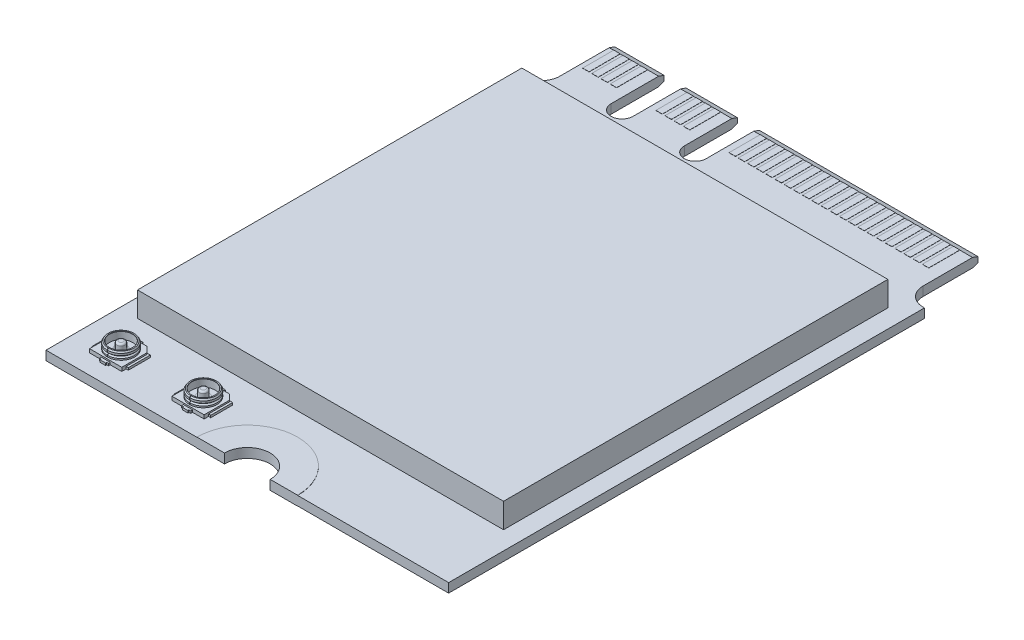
SolidWorks part; units mm, degrees
other "<CONMHF4-SMD-G-T4>-<Boss-Extrude2[1]>"
other "<CONMHF4-SMD-G-T4>-<Cut-Extrude5>"
other "<CONMHF4-SMD-G-T4>-<Boss-Extrude2[3]>"
other "<CONMHF4-SMD-G-T4>-<Boss-Extrude2[2]>"
other "<CONMHF4-SMD-G-T4>-<Chamfer2>"
other "<CONMHF4-SMD-G-T4>-<Boss-Extrude3>"
other "<CONMHF4-SMD-G-T4>-<Fillet3>"
other "<CONMHF4-SMD-G-T4>-<Boss-Extrude2[1]>"
other "<CONMHF4-SMD-G-T4>-<Cut-Extrude5>"
other "<CONMHF4-SMD-G-T4>-<Boss-Extrude2[3]>"
other "<CONMHF4-SMD-G-T4>-<Boss-Extrude2[2]>"
other "<CONMHF4-SMD-G-T4>-<Chamfer2>"
other "<CONMHF4-SMD-G-T4>-<Boss-Extrude3>"
other "<CONMHF4-SMD-G-T4>-<Fillet3>"
ref_plane "Front" through (0, 0, 0) normal (0, 0, 1) x (1, 0, 0)
ref_plane "Top" through (0, 0, 0) normal (0, 1, 0) x (1, 0, 0)
ref_plane "Right" through (0, 0, 0) normal (1, 0, 0) x (0, 0, -1)
sketch "Sketch1" plane through (0, 0, 0) normal (0, 1, 0) x (1, 0, 0)
  line L0 (0, 0) -> (0, 10) construction
  line L1 (1.25, -20) -> (11, -20)
  line L3 (-11, 6) -> (-11, -20)
  line L4 (-11, -20) -> (-1.25, -20)
  line L5 (11, 6) -> (11, -20)
  line L6 (-11, 6) -> (-10.925, 6)
  line L7 (-9.925, 10) -> (-9.925, 7)
  line L8 (9.925, 10) -> (9.925, 7)
  line L9 (10.925, 6) -> (11, 6)
  line L10 (-6.025, 7.1) -> (-6.025, 10)
  line L11 (-2.025, 10) -> (9.925, 10)
  line L12 (-7.225, 7.1) -> (-7.225, 10)
  line L13 (-9.925, 10) -> (-7.225, 10)
  line L15 (0, 10) -> (0, -20) construction
  line L16 (-3.225, 10) -> (-6.025, 10)
  line L18 (0, -50) -> (0, 50) construction
  line L19 (-50, 0) -> (50, 0) construction
  line L20 (-3.225, 10) -> (-3.225, 7.1)
  line L21 (-2.025, 10) -> (-2.025, 7.1)
  arc A0 (1.25, -20) -> (-1.25, -20) centre (0, -20) ccw
  arc A1 (9.925, 7) -> (10.925, 6) centre (10.925, 7) ccw
  arc A2 (-9.925, 7) -> (-10.925, 6) centre (-10.925, 7) cw
  arc A3 (-7.225, 7.1) -> (-6.025, 7.1) centre (-6.625, 7.1) ccw
  arc A5 (-2.025, 7.1) -> (-3.225, 7.1) centre (-2.625, 7.1) cw
  point P3 (-11, 40)
  point P6 (11, 40)
  point P18 (9.925, 6)
  point P42 (9.925, 8.5)
  dimension "D5" = 1.25
  dimension "D2" = 1
  dimension "D12" = 3
  dimension "D1" = 11
  dimension "D3" = 30
  dimension "D4" = 22
  dimension "D6" = 6.625
  dimension "D7" = 2.9
  dimension "D9" = 1.2
  dimension "D10" = 10
  dimension "D11" = 19.85
  dimension "D13" = 2.625
extrude "Boss-Extrude1" add sketch "Sketch1" against normal blind 0.5
sketch "Sketch5" plane through (9.925, 0, 0) normal (1, 0, 0) x (0, 0, -1)
  line L0 (10, 0) -> (9.7, 0)
  line L1 (7, 0) -> (10, 0) construction
  line L2 (10, 0) -> (10, -0.1092)
  line L3 (10, -0.1092) -> (9.7, 0)
  line L4 (10, -0.25) -> (9.7, -0.25) construction
  line L5 (10, -0.5) -> (10, 0) construction
  line L6 (10, -0.3908) -> (9.7, -0.5)
  line L7 (10, -0.5) -> (10, -0.3908)
  line L8 (10, -0.5) -> (9.7, -0.5)
  dimension "D1" = 20
  dimension "D2" = 0.2816
extrude "Cut-Extrude2" cut sketch "Sketch5" against normal through all
sketch "Sketch7" plane through (0, 0, 0) normal (0, 1, 0) x (1, 0, 0)
  line L1 (-10, 5) -> (10, 5)
  line L2 (-10, 5) -> (-10, -16)
  line L3 (-10, -16) -> (10, -16)
  line L4 (10, 5) -> (10, -16)
  line L6 (-11, -20) -> (-1.25, -20) construction
  line L7 (0, 5) -> (0, -16) construction
  line L8 (0, -50) -> (0, 50) construction
  dimension "D1" = 21
  dimension "D2" = 20
  dimension "D3" = 4
extrude "Boss-Extrude3" add sketch "Sketch7" along normal blind 1.35
sketch "Sketch12" plane through (0, -0.5, 0) normal (0, -1, 0) x (1, 0, 0)
  line L0 (-2.75, 20) -> (-1.25, 20)
  line L1 (1.25, 20) -> (2.75, 20)
  arc A1 (-1.25, 20) -> (1.25, 20) centre (0, 20) ccw construction
  arc A4 (-1.25, 20) -> (1.25, 20) centre (0, 20) ccw
  arc A5 (-2.75, 20) -> (2.75, 20) centre (0, 20) ccw
  dimension "D2" = 5.5
extrude "Boss-Extrude6" add sketch "Sketch12" along normal blind 0.01
ref_plane "Plane2" through (0, -0.25, 0) normal (0, 1, 0) x (1, 0, 0)
sketch "Sketch15" plane through (0, 0, 0) normal (0, 1, 0) x (1, 0, 0)
  line L2 (-2.75, -20) -> (-1.25, -20)
  line L3 (1.25, -20) -> (2.75, -20)
  arc A0 (1.25, -20) -> (-1.25, -20) centre (0, -20) ccw construction
  arc A1 (1.25, -20) -> (-1.25, -20) centre (0, -20) ccw
  arc A2 (2.75, -20) -> (-2.75, -20) centre (0, -20) ccw construction
  arc A3 (2.75, -20) -> (-2.75, -20) centre (0, -20) ccw
extrude "Boss-Extrude9" add sketch "Sketch15" along normal blind 0.01
sketch "Sketch18" plane through (0, -0.5, 0) normal (0, -1, 0) x (1, 0, 0)
  line L3 (-9.425, -7.5) -> (-9.075, -7.5)
  line L4 (-8.925, -7.5) -> (-8.575, -7.5)
  line L5 (-8.925, -7.5) -> (-8.925, -9.7)
  line L6 (-9.925, -9.7) -> (-7.225, -9.7) construction
  line L7 (-9.425, -7.5) -> (-9.425, -9.7)
  line L8 (-9.075, -7.5) -> (-9.075, -9.7)
  line L9 (-9.075, -9.7) -> (-9.425, -9.7)
  line L10 (-8.575, -7.5) -> (-8.575, -9.7)
  line L11 (-8.575, -9.7) -> (-8.925, -9.7)
  line L12 (-8.425, -7.5) -> (-8.075, -7.5)
  line L13 (-8.425, -7.5) -> (-8.425, -9.7)
  line L14 (-8.075, -7.5) -> (-8.075, -9.7)
  line L15 (-8.075, -9.7) -> (-8.425, -9.7)
  line L16 (-7.925, -7.5) -> (-7.575, -7.5)
  line L17 (-7.925, -7.5) -> (-7.925, -9.7)
  line L18 (-7.575, -7.5) -> (-7.575, -9.7)
  line L19 (-7.575, -9.7) -> (-7.925, -9.7)
  line L24 (-9.925, -10) -> (-7.225, -10) construction
  line L25 (-7.075, -9.7) -> (-7.425, -9.7)
  line L26 (-7.425, -7.5) -> (-7.425, -9.7)
  line L27 (-7.425, -7.5) -> (-7.075, -7.5)
  line L28 (-7.075, -7.5) -> (-7.075, -9.7)
  point P5 (-7.75, -9.7)
  point P24 (-8.25, -9.7)
  dimension "D1" = 0.35
  dimension "D3" = 0.5
  dimension "D2" = 1.125
  dimension "D4" = 5
  dimension "D5" = 2.5
extrude "Boss-Extrude12" add sketch "Sketch18" along normal blind 0.01
sketch "Sketch19" plane through (0, -0.5, 0) normal (0, -1, 0) x (1, 0, 0)
  line L2 (-7.575, -9.7) -> (-7.575, -7.5) construction
  line L3 (8.575, -7.5) -> (8.925, -7.5)
  line L4 (8.575, -9.7) -> (8.925, -9.7)
  line L5 (8.075, -7.5) -> (8.425, -7.5)
  line L6 (8.575, -7.5) -> (8.575, -9.7)
  line L7 (8.925, -7.5) -> (8.925, -9.7)
  line L8 (8.075, -9.7) -> (8.425, -9.7)
  line L9 (8.075, -7.5) -> (8.075, -9.7)
  line L10 (8.425, -7.5) -> (8.425, -9.7)
  line L11 (7.575, -7.5) -> (7.925, -7.5)
  line L12 (7.575, -9.7) -> (7.925, -9.7)
  line L13 (7.575, -7.5) -> (7.575, -9.7)
  line L14 (7.925, -7.5) -> (7.925, -9.7)
  line L15 (7.075, -7.5) -> (7.425, -7.5)
  line L16 (7.075, -9.7) -> (7.425, -9.7)
  line L17 (7.075, -7.5) -> (7.075, -9.7)
  line L18 (7.425, -7.5) -> (7.425, -9.7)
  line L19 (6.575, -7.5) -> (6.925, -7.5)
  line L20 (6.575, -9.7) -> (6.925, -9.7)
  line L21 (6.575, -7.5) -> (6.575, -9.7)
  line L22 (6.925, -7.5) -> (6.925, -9.7)
  line L23 (6.075, -7.5) -> (6.425, -7.5)
  line L24 (6.075, -9.7) -> (6.425, -9.7)
  line L25 (6.075, -7.5) -> (6.075, -9.7)
  line L26 (6.425, -7.5) -> (6.425, -9.7)
  line L27 (5.575, -7.5) -> (5.925, -7.5)
  line L28 (5.575, -9.7) -> (5.925, -9.7)
  line L29 (5.575, -7.5) -> (5.575, -9.7)
  line L30 (5.925, -7.5) -> (5.925, -9.7)
  line L31 (5.075, -7.5) -> (5.425, -7.5)
  line L32 (5.075, -9.7) -> (5.425, -9.7)
  line L33 (5.075, -7.5) -> (5.075, -9.7)
  line L34 (5.425, -7.5) -> (5.425, -9.7)
  line L35 (4.575, -7.5) -> (4.925, -7.5)
  line L36 (4.575, -9.7) -> (4.925, -9.7)
  line L37 (4.575, -7.5) -> (4.575, -9.7)
  line L38 (4.925, -7.5) -> (4.925, -9.7)
  line L39 (4.075, -7.5) -> (4.425, -7.5)
  line L40 (4.075, -9.7) -> (4.425, -9.7)
  line L41 (4.075, -7.5) -> (4.075, -9.7)
  line L42 (4.425, -7.5) -> (4.425, -9.7)
  line L43 (3.575, -7.5) -> (3.925, -7.5)
  line L44 (3.575, -9.7) -> (3.925, -9.7)
  line L45 (3.575, -7.5) -> (3.575, -9.7)
  line L46 (3.925, -7.5) -> (3.925, -9.7)
  line L47 (3.075, -7.5) -> (3.425, -7.5)
  line L48 (3.075, -9.7) -> (3.425, -9.7)
  line L49 (3.075, -7.5) -> (3.075, -9.7)
  line L50 (3.425, -7.5) -> (3.425, -9.7)
  line L51 (2.575, -7.5) -> (2.925, -7.5)
  line L52 (2.575, -9.7) -> (2.925, -9.7)
  line L53 (2.575, -7.5) -> (2.575, -9.7)
  line L54 (2.925, -7.5) -> (2.925, -9.7)
  line L55 (2.075, -7.5) -> (2.425, -7.5)
  line L56 (2.075, -9.7) -> (2.425, -9.7)
  line L57 (2.075, -7.5) -> (2.075, -9.7)
  line L58 (2.425, -7.5) -> (2.425, -9.7)
  line L59 (1.575, -7.5) -> (1.925, -7.5)
  line L60 (1.575, -9.7) -> (1.925, -9.7)
  line L61 (1.575, -7.5) -> (1.575, -9.7)
  line L62 (1.925, -7.5) -> (1.925, -9.7)
  line L63 (1.075, -7.5) -> (1.425, -7.5)
  line L64 (1.075, -9.7) -> (1.425, -9.7)
  line L65 (1.075, -7.5) -> (1.075, -9.7)
  line L66 (1.425, -7.5) -> (1.425, -9.7)
  line L67 (0.575, -7.5) -> (0.925, -7.5)
  line L68 (0.575, -9.7) -> (0.925, -9.7)
  line L69 (0.575, -7.5) -> (0.575, -9.7)
  line L70 (0.925, -7.5) -> (0.925, -9.7)
  line L71 (0.075, -7.5) -> (0.425, -7.5)
  line L72 (0.075, -9.7) -> (0.425, -9.7)
  line L73 (0.075, -7.5) -> (0.075, -9.7)
  line L74 (0.425, -7.5) -> (0.425, -9.7)
  line L75 (-0.425, -7.5) -> (-0.075, -7.5)
  line L76 (-0.425, -9.7) -> (-0.075, -9.7)
  line L77 (-0.425, -7.5) -> (-0.425, -9.7)
  line L78 (-0.075, -7.5) -> (-0.075, -9.7)
  line L79 (-0.925, -7.5) -> (-0.575, -7.5)
  line L80 (-0.925, -9.7) -> (-0.575, -9.7)
  line L81 (-0.925, -7.5) -> (-0.925, -9.7)
  line L82 (-0.575, -7.5) -> (-0.575, -9.7)
  line L83 (-1.425, -7.5) -> (-1.075, -7.5)
  line L84 (-1.425, -9.7) -> (-1.075, -9.7)
  line L85 (-1.425, -7.5) -> (-1.425, -9.7)
  line L86 (-1.075, -7.5) -> (-1.075, -9.7)
  line L87 (-7.575, -9.7) -> (-7.575, -7.5) construction
  line L88 (-7.575, -7.5) -> (-7.925, -7.5) construction
  line L89 (-7.925, -9.7) -> (-7.575, -9.7) construction
  line L90 (9.075, -7.5) -> (9.425, -7.5)
  line L91 (9.075, -7.5) -> (9.075, -9.7)
  line L92 (9.075, -9.7) -> (9.425, -9.7)
  line L93 (9.425, -7.5) -> (9.425, -9.7)
  line L103 (-3.925, -7.5) -> (-3.575, -7.5)
  line L104 (-3.925, -9.7) -> (-3.575, -9.7)
  line L105 (-3.925, -7.5) -> (-3.925, -9.7)
  line L106 (-3.575, -7.5) -> (-3.575, -9.7)
  line L107 (-4.425, -7.5) -> (-4.075, -7.5)
  line L108 (-4.425, -9.7) -> (-4.075, -9.7)
  line L109 (-4.425, -7.5) -> (-4.425, -9.7)
  line L110 (-4.075, -7.5) -> (-4.075, -9.7)
  line L111 (-4.925, -7.5) -> (-4.575, -7.5)
  line L112 (-4.925, -9.7) -> (-4.575, -9.7)
  line L113 (-4.925, -7.5) -> (-4.925, -9.7)
  line L114 (-4.575, -7.5) -> (-4.575, -9.7)
  line L115 (-5.425, -7.5) -> (-5.075, -7.5)
  line L116 (-5.425, -9.7) -> (-5.075, -9.7)
  line L117 (-5.425, -7.5) -> (-5.425, -9.7)
  line L118 (-5.075, -7.5) -> (-5.075, -9.7)
  line L122 (-1.925, -7.5) -> (-1.575, -7.5)
  line L123 (-1.925, -9.7) -> (-1.575, -9.7)
  line L124 (-1.925, -7.5) -> (-1.925, -9.7)
  line L125 (-1.575, -7.5) -> (-1.575, -9.7)
  line L126 (-2.425, -7.5) -> (-2.075, -7.5)
  line L127 (-2.425, -9.7) -> (-2.075, -9.7)
  line L128 (-2.425, -7.5) -> (-2.425, -9.7)
  line L129 (-2.075, -7.5) -> (-2.075, -9.7)
  line L130 (-2.925, -7.5) -> (-2.575, -7.5)
  line L131 (-2.925, -9.7) -> (-2.575, -9.7)
  line L132 (-2.925, -7.5) -> (-2.925, -9.7)
  line L133 (-2.575, -7.5) -> (-2.575, -9.7)
  line L134 (-3.425, -7.5) -> (-3.075, -7.5)
  line L135 (-3.425, -9.7) -> (-3.075, -9.7)
  line L136 (-3.425, -7.5) -> (-3.425, -9.7)
  line L137 (-3.075, -7.5) -> (-3.075, -9.7)
  point P91 (-3.75, -9.7)
  point P94 (-4.25, -9.7)
  point P103 (9.25, -7.5)
  point P104 (8.75, -7.5)
  dimension "D1" = 29
  dimension "D3" = 0.5
  dimension "D2" = 1.125
  dimension "D4" = 0.5
extrude "Boss-Extrude13" add sketch "Sketch19" along normal blind 0.01
sketch "Sketch21" plane through (0, 0, 0) normal (0, 1, 0) x (1, 0, 0)
  line L0 (8.3819, 9.7) -> (8.7319, 9.7)
  line L1 (9.003, 35.183) -> (9.0027, 38.073) construction
  line L2 (8.3819, 8) -> (8.3819, 9.7)
  line L3 (8.7319, 9.7) -> (8.7319, 8)
  line L4 (8.928, 35.183) -> (9.078, 35.183) construction
  line L5 (8.9277, 38.073) -> (9.0777, 38.073) construction
  line L6 (8.5027, 38.0729) -> (8.503, 35.1829) construction
  line L7 (8.4277, 38.0729) -> (8.5777, 38.0729) construction
  line L8 (8.428, 35.1829) -> (8.578, 35.1829) construction
  line L9 (9.075, 9.7) -> (9.425, 9.7) construction
  line L10 (-2.025, 10) -> (9.925, 10) construction
  line L12 (8.8848, 9.7) -> (9.2348, 9.7)
  line L13 (8.8848, 8) -> (8.8848, 9.7)
  line L14 (9.2348, 9.7) -> (9.2348, 8)
  line L15 (8.8848, 8) -> (9.2348, 8)
  line L16 (8.3819, 8) -> (8.7319, 8)
  line L17 (7.8791, 9.7) -> (8.2291, 9.7)
  line L18 (7.8791, 8) -> (7.8791, 9.7)
  line L19 (8.2291, 9.7) -> (8.2291, 8)
  line L20 (7.8791, 8) -> (8.2291, 8)
  line L21 (7.3762, 9.7) -> (7.7262, 9.7)
  line L22 (7.3762, 8) -> (7.3762, 9.7)
  line L23 (7.7262, 9.7) -> (7.7262, 8)
  line L24 (7.3762, 8) -> (7.7262, 8)
  line L25 (6.8734, 9.7) -> (7.2234, 9.7)
  line L26 (6.8734, 8) -> (6.8734, 9.7)
  line L27 (7.2234, 9.7) -> (7.2234, 8)
  line L28 (6.8734, 8) -> (7.2234, 8)
  line L29 (6.3705, 9.7) -> (6.7205, 9.7)
  line L30 (6.3705, 8) -> (6.3705, 9.7)
  line L31 (6.7205, 9.7) -> (6.7205, 8)
  line L32 (6.3705, 8) -> (6.7205, 8)
  line L33 (5.8677, 9.7) -> (6.2177, 9.7)
  line L34 (5.8677, 8) -> (5.8677, 9.7)
  line L35 (6.2177, 9.7) -> (6.2177, 8)
  line L36 (5.8677, 8) -> (6.2177, 8)
  line L37 (5.3649, 9.7) -> (5.7149, 9.7)
  line L38 (5.3649, 8) -> (5.3649, 9.7)
  line L39 (5.7149, 9.7) -> (5.7149, 8)
  line L40 (5.3649, 8) -> (5.7149, 8)
  line L41 (4.862, 9.7) -> (5.212, 9.7)
  line L42 (4.862, 8) -> (4.862, 9.7)
  line L43 (5.212, 9.7) -> (5.212, 8)
  line L44 (4.862, 8) -> (5.212, 8)
  line L45 (4.3592, 9.7) -> (4.7092, 9.7)
  line L46 (4.3592, 8) -> (4.3592, 9.7)
  line L47 (4.7092, 9.7) -> (4.7092, 8)
  line L48 (4.3592, 8) -> (4.7092, 8)
  line L49 (3.8563, 9.7) -> (4.2063, 9.7)
  line L50 (3.8563, 8) -> (3.8563, 9.7)
  line L51 (4.2063, 9.7) -> (4.2063, 8)
  line L52 (3.8563, 8) -> (4.2063, 8)
  line L53 (3.3535, 9.7) -> (3.7035, 9.7)
  line L54 (3.3535, 8) -> (3.3535, 9.7)
  line L55 (3.7035, 9.7) -> (3.7035, 8)
  line L56 (3.3535, 8) -> (3.7035, 8)
  line L57 (2.8506, 9.7) -> (3.2006, 9.7)
  line L58 (2.8506, 8) -> (2.8506, 9.7)
  line L59 (3.2006, 9.7) -> (3.2006, 8)
  line L60 (2.8506, 8) -> (3.2006, 8)
  line L61 (2.3478, 9.7) -> (2.6978, 9.7)
  line L62 (2.3478, 8) -> (2.3478, 9.7)
  line L63 (2.6978, 9.7) -> (2.6978, 8)
  line L64 (2.3478, 8) -> (2.6978, 8)
  line L65 (1.8449, 9.7) -> (2.1949, 9.7)
  line L66 (1.8449, 8) -> (1.8449, 9.7)
  line L67 (2.1949, 9.7) -> (2.1949, 8)
  line L68 (1.8449, 8) -> (2.1949, 8)
  line L69 (1.3421, 9.7) -> (1.6921, 9.7)
  line L70 (1.3421, 8) -> (1.3421, 9.7)
  line L71 (1.6921, 9.7) -> (1.6921, 8)
  line L72 (1.3421, 8) -> (1.6921, 8)
  line L73 (0.8392, 9.7) -> (1.1892, 9.7)
  line L74 (0.8392, 8) -> (0.8392, 9.7)
  line L75 (1.1892, 9.7) -> (1.1892, 8)
  line L76 (0.8392, 8) -> (1.1892, 8)
  line L77 (0.3364, 9.7) -> (0.6864, 9.7)
  line L78 (0.3364, 8) -> (0.3364, 9.7)
  line L79 (0.6864, 9.7) -> (0.6864, 8)
  line L80 (0.3364, 8) -> (0.6864, 8)
  line L81 (-0.1665, 9.7) -> (0.1835, 9.7)
  line L82 (-0.1665, 8) -> (-0.1665, 9.7)
  line L83 (0.1835, 9.7) -> (0.1835, 8)
  line L84 (-0.1665, 8) -> (0.1835, 8)
  line L85 (-0.6693, 9.7) -> (-0.3193, 9.7)
  line L86 (-0.6693, 8) -> (-0.6693, 9.7)
  line L87 (-0.3193, 9.7) -> (-0.3193, 8)
  line L88 (-0.6693, 8) -> (-0.3193, 8)
  line L89 (-1.1722, 9.7) -> (-0.8222, 9.7)
  line L90 (-1.1722, 8) -> (-1.1722, 9.7)
  line L91 (-0.8222, 9.7) -> (-0.8222, 8)
  line L92 (-1.1722, 8) -> (-0.8222, 8)
  line L93 (-1.675, 9.7) -> (-1.325, 9.7)
  line L94 (-1.675, 8) -> (-1.675, 9.7)
  line L95 (-1.325, 9.7) -> (-1.325, 8)
  line L96 (-1.675, 8) -> (-1.325, 8)
  line L137 (8.575, 9.7) -> (8.925, 9.7) construction
  point P102 (-1.5, 9.7)
  dimension "D2" = 1.125
  dimension "D3" = 2
  dimension "D4" = 0.1528
  dimension "D1" = 22
extrude "Boss-Extrude15" add sketch "Sketch21" along normal blind 0.01
sketch "Sketch22" plane through (0, 0, 0) normal (0, 1, 0) x (1, 0, 0)
  line L0 (-3.225, 9.7) -> (-6.025, 9.7) construction
  line L1 (-5.675, 9.7) -> (-5.325, 9.7)
  line L2 (-5.675, 9.7) -> (-5.675, 8)
  line L3 (-5.675, 8) -> (-5.325, 8)
  line L4 (-5.325, 9.7) -> (-5.325, 8)
  line L5 (-1.675, 9.7) -> (-1.675, 8) construction
  line L6 (-1.675, 8) -> (-1.325, 8) construction
  line L7 (-5.175, 9.7) -> (-4.825, 9.7)
  line L8 (-5.175, 9.7) -> (-5.175, 8)
  line L9 (-4.825, 9.7) -> (-4.825, 8)
  line L10 (-5.175, 8) -> (-4.825, 8)
  line L11 (-4.675, 9.7) -> (-4.325, 9.7)
  line L12 (-4.675, 9.7) -> (-4.675, 8)
  line L13 (-4.325, 9.7) -> (-4.325, 8)
  line L14 (-4.675, 8) -> (-4.325, 8)
  line L15 (-4.175, 9.7) -> (-3.825, 9.7)
  line L16 (-4.175, 9.7) -> (-4.175, 8)
  line L17 (-3.825, 9.7) -> (-3.825, 8)
  line L18 (-4.175, 8) -> (-3.825, 8)
  point P6 (-5.5, 9.7)
  point P13 (-5.5, 8)
  point P25 (-5, 8)
  dimension "D1" = 1.125
  dimension "D3" = 0.5
  dimension "D2" = 4
extrude "Boss-Extrude16" add sketch "Sketch22" along normal up to surface (0.01 mm away)
sketch "Sketch23" plane through (0, 0, 0) normal (0, 1, 0) x (1, 0, 0)
  line L0 (-7.225, 9.7) -> (-9.925, 9.7) construction
  line L1 (-7.825, 9.7) -> (-8.175, 9.7)
  line L2 (-7.825, 9.7) -> (-7.825, 8)
  line L3 (-7.825, 8) -> (-8.175, 8)
  line L4 (-8.175, 9.7) -> (-8.175, 8)
  line L5 (-5.5, 9.7) -> (-5.5, 8) construction
  line L6 (-5.675, 9.7) -> (-5.675, 8) construction
  line L7 (-5.675, 9.7) -> (-5.325, 9.7) construction
  line L8 (-5.325, 8) -> (-5.675, 8) construction
  line L9 (-5.675, 8) -> (-5.675, 9.7) construction
  line L10 (-8.325, 9.7) -> (-8.675, 9.7)
  line L11 (-8.675, 9.7) -> (-8.675, 8)
  line L12 (-8.325, 8) -> (-8.675, 8)
  line L13 (-8.325, 9.7) -> (-8.325, 8)
  line L14 (-8.825, 9.7) -> (-9.175, 9.7)
  line L15 (-9.175, 9.7) -> (-9.175, 8)
  line L16 (-8.825, 8) -> (-9.175, 8)
  line L17 (-8.825, 9.7) -> (-8.825, 8)
  line L18 (-9.325, 9.7) -> (-9.675, 9.7)
  line L19 (-9.675, 9.7) -> (-9.675, 8)
  line L20 (-9.325, 8) -> (-9.675, 8)
  line L21 (-9.325, 9.7) -> (-9.325, 8)
  point P11 (-8.5, 9.7)
  point P17 (-8, 9.7)
  dimension "D1" = 0.175
  dimension "D2" = 2.5
  dimension "D3" = 4
  dimension "D4" = 0.5
extrude "Boss-Extrude17" add sketch "Sketch23" along normal up to surface (0.01 mm away)
sketch "Sketch24" plane through (0, 0, 0) normal (0, 1, 0) x (1, 0, 0)
  line L1 (0, -50) -> (0, 50) construction
  line L2 (-11, -20) -> (-2.75, -20) construction
  circle A0 centre (-4.3, -18.1) radius 0.5
  circle A1 centre (-8.8, -18.1) radius 0.5
  dimension "D1" = 1
  dimension "D2" = 4.5
  dimension "D3" = 8.8
  dimension "D4" = 1.9
ref_plane "Front Plane-CONMHF4-SMD-G-T4" through (-4.3, 0, 18.1) normal (0, 0, 1) x (1, 0, 0)
ref_plane "Top Plane-CONMHF4-SMD-G-T4" through (-4.3, 0, 18.1) normal (0, 1, 0) x (1, 0, 0)
ref_plane "Right Plane-CONMHF4-SMD-G-T4" through (-4.3, 0, 18.1) normal (1, 0, 0) x (0, 0, -1)
inserted part "CONMHF4-SMD-G-T4"
move or copy body "Body-Move/Copy2" placed by mates yes parameters "D1"=0, "D2"=0, "D3"=0
ref_plane "Front Plane-CONMHF4-SMD-G-T42" through (-8.8, 0, 18.1) normal (0, 0, 1) x (1, 0, 0)
ref_plane "Top Plane-CONMHF4-SMD-G-T42" through (-8.8, 0, 18.1) normal (0, 1, 0) x (1, 0, 0)
ref_plane "Right Plane-CONMHF4-SMD-G-T42" through (-8.8, 0, 18.1) normal (1, 0, 0) x (0, 0, -1)
inserted part "CONMHF4-SMD-G-T42" parameters "D1"=0, "D2"=0, "D3"=0
move or copy body "Body-Move/Copy4"
sketch "Sketch25" plane through (0, 1.35, 0) normal (0, 1, 0) x (1, 0, 0)
  line L0 (76.2621, -5.5506) -> (-90.4045, -5.5506) construction
